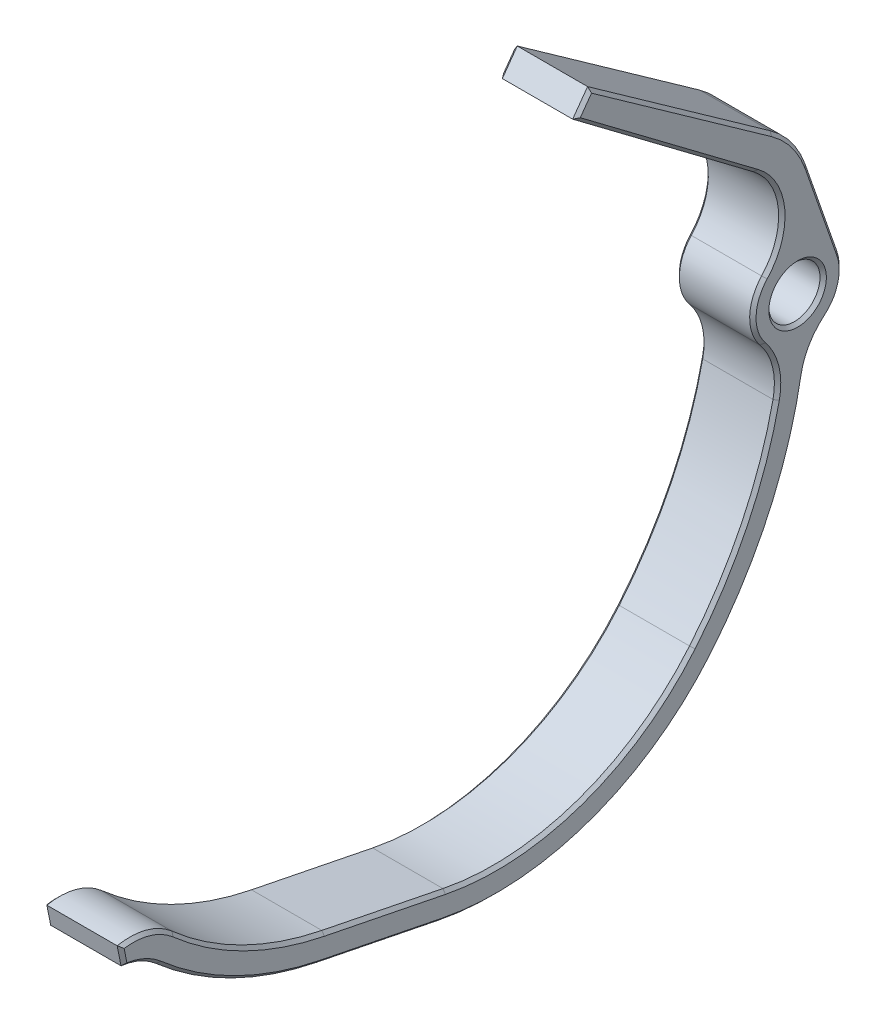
SolidWorks part; units mm, degrees
ref_plane "Спереди" through (0, 0, 0) normal (0, 0, 1) x (1, 0, 0)
ref_plane "Сверху" through (0, 0, 0) normal (0, 1, 0) x (1, 0, 0)
ref_plane "Справа" through (0, 0, 0) normal (1, 0, 0) x (0, 0, -1)
sketch "Эскиз1" plane through (0, 0, 0) normal (1, 0, 0) x (0, 0, -1)
  line L0 (-36.9711, -24.7558) -> (-27.494, -26.6589)
  line L1 (-17.3478, 20.3907) -> (-3.2296, 9.7734)
  line L2 (-16.1807, 22.0149) -> (-1.9012, 11.8879)
  line L3 (-32, 0) -> (-17.3478, 20.3907) construction
  line L4 (-32, 0) -> (0, 0) construction
  line L5 (-17.3478, 20.3907) -> (-16.1807, 22.0149)
  line L6 (3.3058, 1.1496) -> (0.8408, 8.2379)
  line L7 (-33.1354, 3.0839) -> (11.583, -5.8958) construction
  line L8 (-37.3648, -26.7167) -> (-27.8877, -28.6197)
  line L9 (0.3777, 3.4806) -> (0.3777, 3.4806)
  line L10 (0.3777, 3.4806) -> (0.3777, 3.4806)
  line L11 (0.3777, 3.4806) -> (0.3777, 3.4806)
  line L12 (-52.6777, -19.3033) -> (-52.9797, -17.7919)
  line L13 (1.4168, 0.4927) -> (0.3777, 3.4806) construction
  line L14 (-52, -22.695) -> (-52, -17.695) construction
  circle A0 centre (0, 0) radius 2
  arc A1 (-1.1003, 1.0195) -> (-1.1588, -0.9525) centre (0, 0) ccw construction
  arc A2 (-8.2046, -19.869) -> (-1.6753, -6.4354) centre (-32, 0) ccw
  arc A3 (-48.6942, -18.9438) -> (-36.9711, -24.7558) centre (-32, 0) ccw
  arc A4 (-27.494, -26.6589) -> (-8.2046, -19.869) centre (-23.5565, -7.0503) ccw
  arc A5 (-2.5673, 2.3789) -> (-3.2296, 9.7734) centre (-6.2348, 5.7773) ccw
  arc A6 (-1.6753, -6.4354) -> (-2.7038, -2.2225) centre (-6.5664, -5.3974) ccw
  arc A7 (0.8408, 8.2379) -> (-1.9012, 11.8879) centre (-6.2348, 5.7773) ccw
  arc A8 (-2.5673, 2.3789) -> (-2.7038, -2.2225) centre (0, 0) ccw
  arc A9 (-48.6942, -18.9438) -> (-52.9797, -17.7919) centre (-52, -22.695) ccw
  arc A10 (-50.0165, -20.4442) -> (-37.3648, -26.7167) centre (-32, 0) ccw
  arc A11 (-27.8877, -28.6197) -> (-6.6694, -21.1509) centre (-23.5565, -7.0503) ccw
  arc A12 (-6.6694, -21.1509) -> (0.5081, -5.6764) centre (-32, 0) ccw
  arc A13 (-6.6694, -21.1509) -> (0.2811, -6.8506) centre (-32, 0) ccw construction
  arc A14 (-1.1003, 1.0195) -> (0.3777, 3.4806) centre (-6.2348, 5.7773) ccw construction
  arc A15 (-49.9428, -20.509) -> (-52.6777, -19.3033) centre (-53.235, -24.2722) ccw
  arc A16 (0.3777, 3.4806) -> (0.3777, 3.4806) centre (0.3777, 3.4806) ccw
  arc A18 (2.2374, -2.6915) -> (0.5081, -5.6764) centre (5.4336, -6.5365) ccw
  arc A19 (0.2811, -6.8506) -> (-1.1588, -0.9525) centre (-6.5664, -5.3974) ccw construction
  arc A20 (2.2374, -2.6915) -> (3.3058, 1.1496) centre (0, 0) ccw
  arc A21 (-1.1758, -3.2966) -> (3.3058, 1.1496) centre (0, 0) ccw construction
  arc A22 (-0.5039, -1.4128) -> (1.4168, 0.4927) centre (0, 0) ccw construction
  dimension "D1" = 4
  dimension "D2" = 3.5
  dimension "D3" = 62
  dimension "D5" = 50.5
  dimension "D6" = 40
  dimension "D10" = 10
  dimension "D14" = 10
  dimension "D4" = 32
  dimension "D7" = 5.87
  dimension "D8" = 25.59
  dimension "D9" = 28.05
  dimension "D11" = 1.6
  dimension "D12" = 54.3
  dimension "D13" = 2
  dimension "D15" = 20
  dimension "D16" = 2
  dimension "D17" = 1.235
  dimension "D18" = 11.3
extrude "Бобышка-Вытянуть1" add sketch "Эскиз1" along normal blind 6
chamfer "Фаска1" distance 0.25 angle 45 44 edges at (0, 0, -2) (0, -24.436, 44.06) (0, -27.6682, 32.6263) (0, -27.8022, 16.2518) (0, -13.8855, 2.0635) (0, -4.0301, -1.1072) (0, -0.938, -3.372) (0, 4.6938, -2.0733) (0, 10.2768, 0.2454) (0, 16.9514, 9.0409) (0, 21.2028, 16.7642) (0, 15.0821, 10.2887) (0, 6.2234, 1.2547) (0, 0.1038, 3.4985) (0, -4.2116, 1.7091) (0, -13.5513, 4.1188) (0, -25.9157, 16.9159) (0, -25.7073, 32.2325) (0, -22.6224, 43.2157) (0, -17.8664, 50.7022) (0, -18.5476, 52.8287) (0, -19.697, 51.218) (6, 0, -2) (6, -18.5476, 52.8287) (6, -17.8664, 50.7022) (6, -22.6224, 43.2157) (6, -25.7073, 32.2325) (6, -25.9157, 16.9159) (6, -13.5513, 4.1188) (6, -4.2116, 1.7091) (6, 0.1038, 3.4985) (6, 6.2234, 1.2547) (6, 15.0821, 10.2887) (6, 21.2028, 16.7642) (6, 16.9514, 9.0409) (6, 10.2768, 0.2454) (6, 4.6938, -2.0733) (6, -0.938, -3.372) (6, -4.0301, -1.1072) (6, -13.8855, 2.0635) (6, -27.8022, 16.2518) (6, -27.6682, 32.6263) (6, -24.436, 44.06) (6, -19.697, 51.218)
